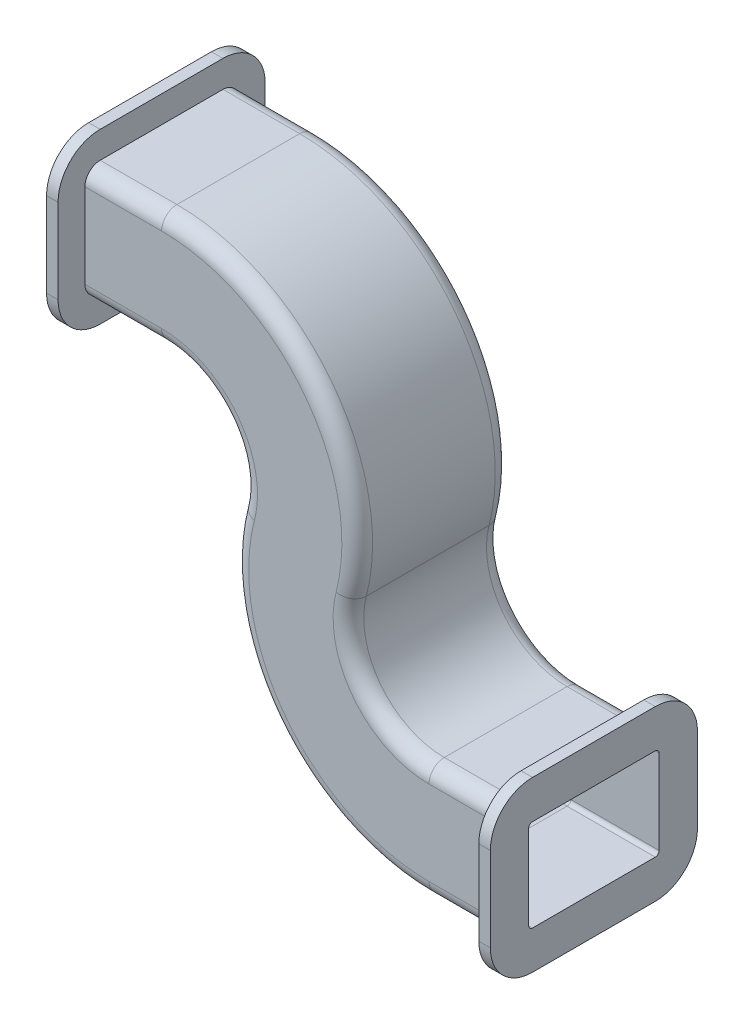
SolidWorks part; units mm, degrees
ref_plane "Front Plane" through (0, 0, 0) normal (0, 0, 1) x (1, 0, 0)
ref_plane "Top Plane" through (0, 0, 0) normal (0, 1, 0) x (1, 0, 0)
ref_plane "Right Plane" through (0, 0, 0) normal (1, 0, 0) x (0, 0, -1)
sketch "Sketch1" plane through (0, 0, 0) normal (0, 0, 1) x (1, 0, 0)
  line L0 (0, 0) -> (25.4, 0)
  line L1 (113.9364, -114.3) -> (139.3364, -114.3)
  arc A0 (25.4, 0) -> (69.6682, -57.15) centre (25.4, -45.72) cw
  arc A1 (69.6682, -57.15) -> (113.9364, -114.3) centre (113.9364, -68.58) ccw
  dimension "D1" = 45.72
  dimension "D2" = 25.4
  dimension "D3" = 25.4
  dimension "D4" = 114.3
sketch "Sketch2" plane through (0, 0, 0) normal (1, 0, 0) x (0, 0, -1)
  line L1 (-20.32, -19.05) -> (20.32, -19.05)
  line L2 (-25.4, -13.97) -> (-25.4, 13.97)
  line L3 (-20.32, 19.05) -> (20.32, 19.05)
  line L4 (25.4, -13.97) -> (25.4, 13.97)
  line L5 (-25.4, -19.05) -> (25.4, 19.05) construction
  line L6 (-25.4, 19.05) -> (25.4, -19.05) construction
  arc A0 (20.32, 19.05) -> (25.4, 13.97) centre (20.32, 13.97) cw
  arc A1 (20.32, -19.05) -> (25.4, -13.97) centre (20.32, -13.97) ccw
  arc A2 (-20.32, -19.05) -> (-25.4, -13.97) centre (-20.32, -13.97) cw
  arc A3 (-25.4, 13.97) -> (-20.32, 19.05) centre (-20.32, 13.97) cw
  point P0 (0, 0)
  dimension "D3" = 5.08
  dimension "D1" = 38.1
  dimension "D2" = 50.8
sweep "Sweep-Thin1" add profiles "Sketch2" path "Sketch1" parameters "D1"=3.81
sketch "Sketch3" plane through (0, 0, 0) normal (-1, 0, 0) x (0, 0, 1)
  line L0 (0, 0) -> (0, 10.4745) construction
  line L21 (20.32, -15.24) -> (-20.32, -15.24) construction
  line L22 (21.59, 13.97) -> (21.59, -13.97) construction
  line L23 (-20.32, 15.24) -> (20.32, 15.24) construction
  line L24 (-21.59, -13.97) -> (-21.59, 13.97) construction
  line L29 (20.32, 27.94) -> (-20.32, 27.94)
  line L30 (34.29, -13.97) -> (34.29, 13.97)
  line L31 (-20.32, -27.94) -> (20.32, -27.94)
  line L32 (-34.29, 13.97) -> (-34.29, -13.97)
  line L33 (20.32, -15.24) -> (-20.32, -15.24)
  line L34 (21.59, 13.97) -> (21.59, -13.97)
  line L35 (-20.32, 15.24) -> (20.32, 15.24)
  line L36 (-21.59, -13.97) -> (-21.59, 13.97)
  arc A20 (-21.59, -13.97) -> (-20.32, -15.24) centre (-20.32, -13.97) ccw construction
  arc A21 (20.32, -15.24) -> (21.59, -13.97) centre (20.32, -13.97) ccw construction
  arc A22 (21.59, 13.97) -> (20.32, 15.24) centre (20.32, 13.97) ccw construction
  arc A23 (-20.32, 15.24) -> (-21.59, 13.97) centre (-20.32, 13.97) ccw construction
  arc A28 (34.29, 13.97) -> (20.32, 27.94) centre (20.32, 13.97) ccw
  arc A29 (20.32, -27.94) -> (34.29, -13.97) centre (20.32, -13.97) ccw
  arc A30 (-34.29, -13.97) -> (-20.32, -27.94) centre (-20.32, -13.97) ccw
  arc A31 (-20.32, 27.94) -> (-34.29, 13.97) centre (-20.32, 13.97) ccw
  arc A32 (-21.59, -13.97) -> (-20.32, -15.24) centre (-20.32, -13.97) ccw
  arc A33 (20.32, -15.24) -> (21.59, -13.97) centre (20.32, -13.97) ccw
  arc A34 (21.59, 13.97) -> (20.32, 15.24) centre (20.32, 13.97) ccw
  arc A35 (-20.32, 15.24) -> (-21.59, 13.97) centre (-20.32, 13.97) ccw
  dimension "D2" = 55.88
  dimension "D5" = 13.97
  dimension "D1" = 68.58
  dimension "D3" = 12.7
  dimension "D4" = 12.7
extrude "Boss-Extrude1" add sketch "Sketch3" along normal blind 3.81
sketch "Sketch4" plane through (139.3364, 0, 0) normal (1, 0, 0) x (0, 0, -1)
  line L0 (21.59, -128.27) -> (21.59, -100.33) construction
  line L1 (20.32, -99.06) -> (-20.32, -99.06) construction
  line L2 (-21.59, -100.33) -> (-21.59, -128.27) construction
  line L3 (-20.32, -129.54) -> (20.32, -129.54) construction
  line L4 (21.59, -128.27) -> (21.59, -100.33)
  line L5 (20.32, -99.06) -> (-20.32, -99.06)
  line L6 (-21.59, -100.33) -> (-21.59, -128.27)
  line L7 (-20.32, -129.54) -> (20.32, -129.54)
  line L8 (-25.4, -100.33) -> (-25.4, -128.27) construction
  line L9 (-20.32, -133.35) -> (20.32, -133.35) construction
  line L36 (-20.32, -142.24) -> (20.32, -142.24)
  line L37 (34.29, -128.27) -> (34.29, -100.33)
  line L38 (20.32, -86.36) -> (-20.32, -86.36)
  line L39 (-34.29, -100.33) -> (-34.29, -128.27)
  arc A0 (20.32, -129.54) -> (21.59, -128.27) centre (20.32, -128.27) ccw construction
  arc A1 (21.59, -100.33) -> (20.32, -99.06) centre (20.32, -100.33) ccw construction
  arc A2 (-20.32, -99.06) -> (-21.59, -100.33) centre (-20.32, -100.33) ccw construction
  arc A3 (-21.59, -128.27) -> (-20.32, -129.54) centre (-20.32, -128.27) ccw construction
  arc A4 (20.32, -129.54) -> (21.59, -128.27) centre (20.32, -128.27) ccw
  arc A5 (21.59, -100.33) -> (20.32, -99.06) centre (20.32, -100.33) ccw
  arc A6 (-20.32, -99.06) -> (-21.59, -100.33) centre (-20.32, -100.33) ccw
  arc A7 (-21.59, -128.27) -> (-20.32, -129.54) centre (-20.32, -128.27) ccw
  arc A32 (-34.29, -128.27) -> (-20.32, -142.24) centre (-20.32, -128.27) ccw
  arc A33 (20.32, -142.24) -> (34.29, -128.27) centre (20.32, -128.27) ccw
  arc A34 (34.29, -100.33) -> (20.32, -86.36) centre (20.32, -100.33) ccw
  arc A35 (-20.32, -86.36) -> (-34.29, -100.33) centre (-20.32, -100.33) ccw
  dimension "D5" = 13.97
  dimension "D1" = 68.58
  dimension "D2" = 55.88
  dimension "D3" = 8.89
  dimension "D4" = 8.89
extrude "Boss-Extrude2" add sketch "Sketch4" along normal blind 3.81
